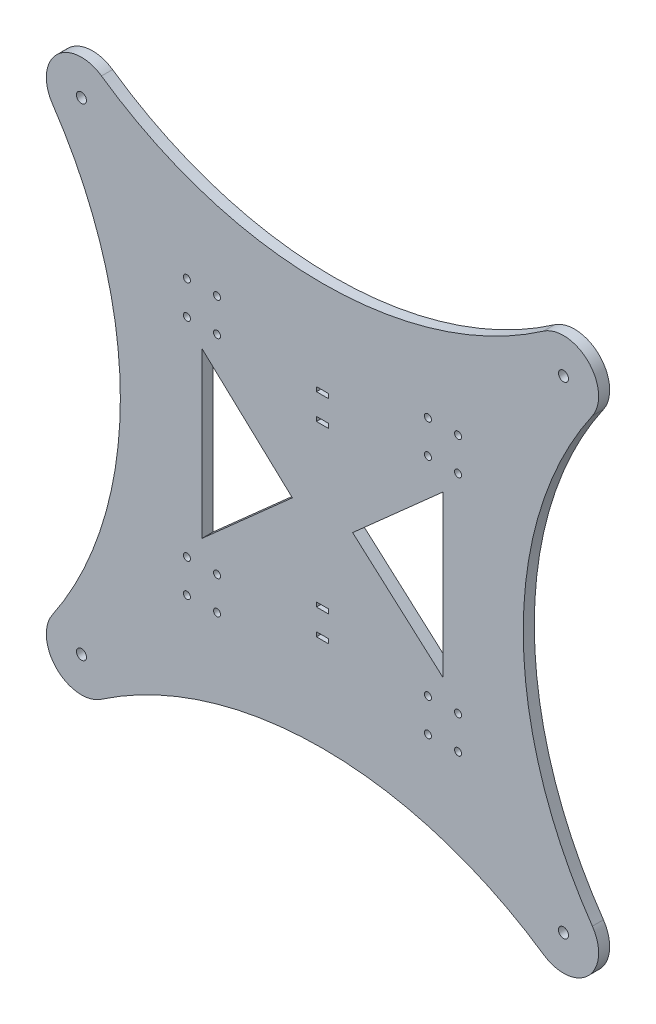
SolidWorks part; units mm, degrees
ref_plane "Front Plane" through (0, 0, 0) normal (0, 0, 1) x (1, 0, 0)
ref_plane "Top Plane" through (0, 0, 0) normal (0, 1, 0) x (1, 0, 0)
ref_plane "Right Plane" through (0, 0, 0) normal (1, 0, 0) x (0, 0, -1)
sketch "Sketch1" plane through (0, 0, 0) normal (0, 0, 1) x (1, 0, 0)
  line L0 (0, 0) -> (-240, 0) construction
  line L1 (-240, 0) -> (-240, 240) construction
  line L2 (-240, 240) -> (0, 240) construction
  line L3 (0, 240) -> (0, 0) construction
  line L4 (0, 0) -> (-240, 240) construction
  line L5 (-180, 120) -> (-60, 120) construction
  line L6 (0, 240) -> (-240, 0) construction
  line L7 (-120, 120) -> (-120, 20) construction
  line L8 (-120, 120) -> (-20, 120) construction
  line L9 (-50, 120) -> (-190, 120) construction
  line L10 (-105, 120) -> (-135, 120) construction
  line L11 (-135, 120) -> (-148.2843, 91.7157) construction
  line L12 (-148.2843, 91.7157) -> (-148.2843, 148.2843) construction
  line L13 (-187.5, 68.25) -> (-172.5, 68.25) construction
  line L14 (-172.5, 68.25) -> (-172.5, 51.75) construction
  line L15 (-172.5, 51.75) -> (-187.5, 51.75) construction
  line L16 (-187.5, 51.75) -> (-187.5, 68.25) construction
  line L17 (-148.2843, 148.2843) -> (-135, 120) construction
  line L18 (-91.7157, 91.7157) -> (-105, 120) construction
  line L19 (-105, 120) -> (-91.7157, 148.2843) construction
  line L20 (-91.7157, 148.2843) -> (-91.7157, 91.7157) construction
  line L21 (-160, 80) -> (-161.8455, 161.8455) construction
  line L22 (-80, 80) -> (-80, 160) construction
  line L23 (-80, 160) -> (-105, 120) construction
  line L24 (-105, 120) -> (-80, 80) construction
  line L25 (-160, 80) -> (-135, 120) construction
  line L26 (-135, 120) -> (-161.8455, 161.8455) construction
  line L27 (-135, 80) -> (-105, 80) construction
  line L28 (-105, 80) -> (-105, 160) construction
  line L29 (-105, 160) -> (-135, 160) construction
  line L30 (-135, 160) -> (-135, 80) construction
  line L31 (-60, 68.25) -> (-52.5, 68.25) construction
  line L32 (-180, 39.4408) -> (-180, 200.5592) construction
  line L33 (-60, 39.4408) -> (-60, 200.5592) construction
  line L34 (-135, 82.75) -> (-135, 77.25) construction
  line L35 (-135, 77.25) -> (-105, 77.25) construction
  line L36 (-105, 77.25) -> (-105, 82.75) construction
  line L37 (-105, 82.75) -> (-135, 82.75) construction
  line L38 (-135, 162.75) -> (-135, 157.25) construction
  line L39 (-135, 157.25) -> (-105, 157.25) construction
  line L40 (-105, 157.25) -> (-105, 162.75) construction
  line L41 (-105, 162.75) -> (-135, 162.75) construction
  line L42 (-52.5, 68.25) -> (-52.5, 51.75) construction
  line L43 (-52.5, 51.75) -> (-67.5, 51.75) construction
  line L44 (-67.5, 51.75) -> (-67.5, 68.25) construction
  line L45 (-180, 68.25) -> (-180, 51.75) construction
  line L46 (-180, 51.75) -> (-60, 51.75) construction
  line L47 (-60, 51.75) -> (-60, 68.25) construction
  line L48 (-60, 68.25) -> (-180, 68.25) construction
  line L49 (-180, 171.75) -> (-180, 188.25) construction
  line L50 (-180, 188.25) -> (-60, 188.25) construction
  line L51 (-60, 188.25) -> (-60, 171.75) construction
  line L52 (-60, 171.75) -> (-180, 171.75) construction
  line L53 (-67.5, 68.25) -> (-60, 68.25) construction
  line L54 (-187.5, 188.25) -> (-172.5, 188.25) construction
  line L55 (-172.5, 188.25) -> (-172.5, 171.75) construction
  line L56 (-172.5, 171.75) -> (-187.5, 171.75) construction
  line L57 (-187.5, 171.75) -> (-187.5, 188.25) construction
  line L58 (-52.5, 188.25) -> (-67.5, 188.25) construction
  line L59 (-67.5, 188.25) -> (-67.5, 171.75) construction
  line L60 (-67.5, 171.75) -> (-52.5, 171.75) construction
  line L61 (-52.5, 171.75) -> (-52.5, 188.25) construction
  line L62 (-117, 80) -> (-123, 80) construction
  line L63 (-123, 80) -> (-128.5, 80) construction
  line L64 (-117, 80) -> (-111.5, 80) construction
  line L65 (-111.5, 77.25) -> (-111.5, 162.75) construction
  line L66 (-111.5, 162.75) -> (-128.5, 162.75) construction
  line L67 (-128.5, 162.75) -> (-128.5, 77.25) construction
  line L68 (-117, 160) -> (-123, 160) construction
  line L69 (-123, 162.75) -> (-123, 157.25) construction
  line L70 (-117, 162.75) -> (-117, 157.25) construction
  line L93 (-123, 81.1) -> (-123, 78.9)
  line L94 (-123, 78.9) -> (-117, 78.9)
  line L95 (-117, 78.9) -> (-117, 81.1)
  line L96 (-117, 81.1) -> (-123, 81.1)
  line L97 (-123, 160) -> (-123, 158.9)
  line L98 (-123, 158.9) -> (-117, 158.9)
  line L99 (-117, 158.9) -> (-117, 161.1)
  line L100 (-117, 161.1) -> (-123, 161.1)
  line L101 (-123, 161.1) -> (-123, 160)
  line L102 (-120, 120) -> (-220, 120) construction
  line L103 (-120, 120) -> (-120, 220) construction
  line L104 (-180, 80) -> (-135, 120)
  line L105 (-180, 80) -> (-180, 161.8455)
  line L106 (-180, 161.8455) -> (-135, 120)
  line L107 (-105, 120) -> (-60, 80)
  line L108 (-60, 80) -> (-60, 160)
  line L109 (-60, 160) -> (-105, 120)
  line L110 (-123, 173.95) -> (-123, 171.75)
  line L111 (-123, 171.75) -> (-117, 171.75)
  line L112 (-117, 171.75) -> (-117, 173.95)
  line L113 (-117, 173.95) -> (-123, 173.95)
  line L114 (-123, 68.25) -> (-123, 66.05)
  line L115 (-123, 66.05) -> (-117, 66.05)
  line L116 (-117, 66.05) -> (-117, 68.25)
  line L117 (-117, 68.25) -> (-123, 68.25)
  circle A4 centre (-187.5, 188.25) radius 1.75
  circle A5 centre (-172.5, 188.25) radius 1.75
  circle A6 centre (-187.5, 171.75) radius 1.75
  circle A7 centre (-172.5, 171.75) radius 1.75
  circle A8 centre (-67.5, 188.25) radius 1.75
  circle A9 centre (-52.5, 188.25) radius 1.75
  circle A10 centre (-67.5, 171.75) radius 1.75
  circle A11 centre (-52.5, 171.75) radius 1.75
  circle A12 centre (-187.5, 68.25) radius 1.75
  circle A13 centre (-172.5, 68.25) radius 1.75
  circle A14 centre (-187.5, 51.75) radius 1.75
  circle A15 centre (-172.5, 51.75) radius 1.75
  circle A16 centre (-67.5, 68.25) radius 1.75
  circle A17 centre (-52.5, 68.25) radius 1.75
  circle A18 centre (-67.5, 51.75) radius 1.75
  circle A19 centre (-52.5, 51.75) radius 1.75
  circle A20 centre (-240, 240) radius 2.5
  circle A21 centre (0, 240) radius 2.5
  circle A22 centre (-240, 0) radius 2.5
  circle A23 centre (0, 0) radius 2.5
  arc A24 (-254.482, 9.8246) -> (-230.1464, -14.4622) centre (-240, 0) ccw
  arc A25 (-230.0243, 254.3783) -> (-254.482, 230.1754) centre (-240, 240) ccw
  arc A27 (-254.482, 9.8246) -> (-254.482, 230.1754) centre (-416.8857, 120) ccw
  arc A28 (14.3807, 230.0277) -> (-9.9757, 254.3783) centre (0, 240) ccw
  arc A29 (-9.8536, -14.4622) -> (14.3807, 9.9723) centre (0, 0) ccw
  arc A30 (-230.0243, 254.3783) -> (-9.9757, 254.3783) centre (-120, 412.9591) ccw
  arc A31 (14.3807, 9.9723) -> (14.3807, 230.0277) centre (173.0485, 120) cw
  arc A32 (-230.1464, -14.4622) -> (-9.8536, -14.4622) centre (-120, -176.1255) cw
  point P12 (-123, 80)
  point P21 (-123, 172.85)
  point P29 (-120, 120)
  point P32 (-120, 120)
  point P38 (-180, 68.25)
  point P51 (-120, 80)
  point P63 (-135, 80)
  point P68 (-135, 160)
  point P71 (-180, 188.25)
  point P78 (-180, 60)
  point P83 (-180, 180)
  point P85 (-60, 188.25)
  point P111 (-120, 80)
  point P120 (-120, 160)
  point P129 (-123, 67.15)
  dimension "D2" = 100
  dimension "D3" = 100
  dimension "D6" = 100
  dimension "D7" = 30
  dimension "D9" = 16.5
  dimension "D4" = 240
  dimension "D5" = 240
  dimension "D8" = 240
  dimension "D10" = 16.5
  dimension "D11" = 5.5
  dimension "D12" = 5.5
extrude "Boss-Extrude1" add sketch "Sketch1" along normal blind 5.5
